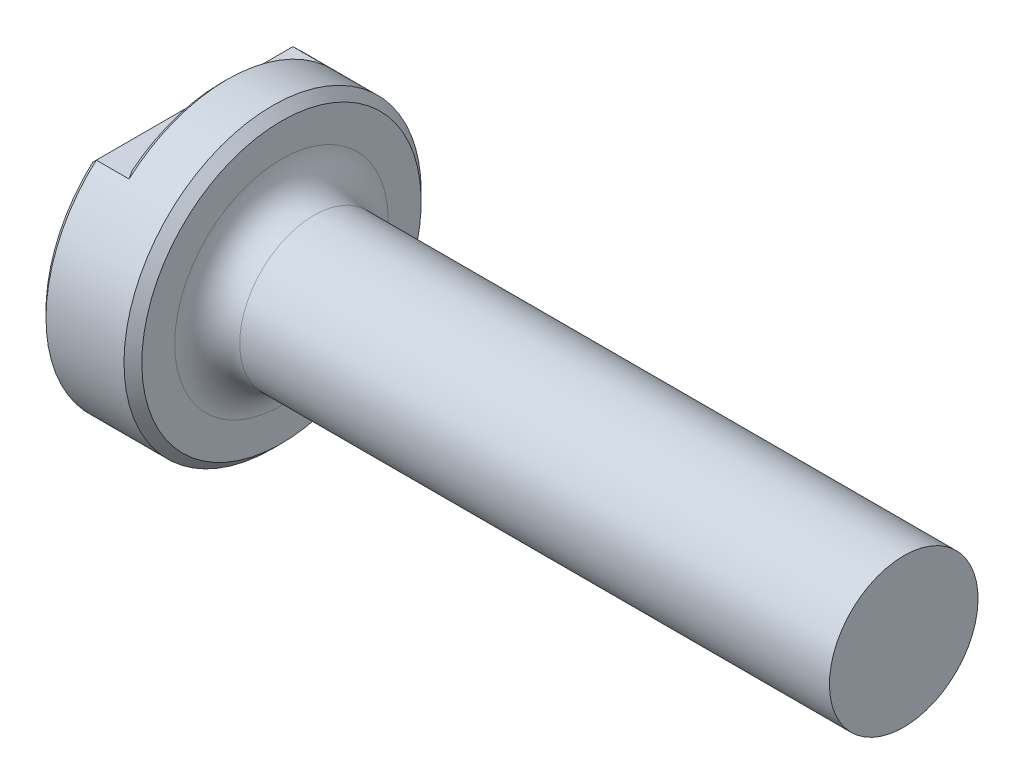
SolidWorks part; units mm, degrees
ref_plane "Front Plane" through (0, 0, 0) normal (0, 0, 1) x (1, 0, 0)
ref_plane "Top Plane" through (0, 0, 0) normal (0, 1, 0) x (1, 0, 0)
ref_plane "Right Plane" through (0, 0, 0) normal (1, 0, 0) x (0, 0, -1)
sketch "Sketch1" plane through (0, 0, 0) normal (1, 0, 0) x (0, 0, -1)
  circle A0 centre (0, 0) radius 25.4
  dimension "Rod Dia" = 50.8
extrude "Boss-Extrude1" add sketch "Sketch1" along normal mid plane 122.2375 contours A0
sketch "Sketch3" plane through (-61.1187, 0, 0) normal (-1, 0, 0) x (0, 0, 1)
  line L1 (-25.4, 25.4) -> (25.4, 25.4)
  line L2 (-25.4, 25.4) -> (-25.4, 19.05)
  line L3 (-25.4, 19.05) -> (25.4, 19.05)
  line L4 (25.4, 25.4) -> (25.4, 19.05)
  line L5 (-25.4, 25.4) -> (25.4, 19.05) construction
  line L6 (-25.4, 19.05) -> (25.4, 25.4) construction
  circle A0 centre (0, 0) radius 25.4 construction
  point P0 (0, 22.225)
  dimension "D1" = 19.05
extrude "Cut-Extrude1" cut sketch "Sketch3" against normal blind 5.588
sketch "Sketch5" plane through (0, 0, 0) normal (0, 0, 1) x (1, 0, 0)
  line L0 (61.1187, 0) -> (-61.1187, 0) construction
  line L1 (61.1187, -25.4) -> (61.1187, 25.4) construction
  line L2 (-61.1187, 19.05) -> (-61.1187, -25.4) construction
  line L3 (-45.2437, -12.7) -> (61.1187, -12.7)
  line L4 (61.1187, -12.7) -> (61.1187, -25.4)
  line L5 (61.1187, -25.4) -> (-45.2437, -25.4)
  line L6 (-61.1187, -25.4) -> (61.1187, -25.4) construction
  line L7 (-45.2437, -25.4) -> (-45.2437, -12.7)
  dimension "B" = 15.875
  dimension "D" = 25.4
revolve "Cut-Revolve1" cut sketch "Sketch5" angle 360 about L0
sketch "Sketch6" plane through (0, 0, 0) normal (0, 0, 1) x (1, 0, 0)
  line L0 (61.1187, 0) -> (-61.1187, 0) construction
  line L1 (61.1187, -12.7) -> (61.1187, 12.7) construction
  line L2 (-61.1187, 19.05) -> (-61.1187, -25.4) construction
  line L3 (-56.4959, 0) -> (-61.1187, 0)
  line L5 (-61.1188, 12.4402) -> (-61.1187, 0)
  arc A0 (-61.1188, 12.4402) -> (-56.4959, 0) centre (-75.546, 0) cw
  dimension "D1" = 19.05
  dimension "D2" = 4.6228
revolve "Cut-Revolve2" cut sketch "Sketch6" angle 360 about L0
sketch "Sketch7" plane through (0, 0, 0) normal (0, 0, 1) x (1, 0, 0)
  line L0 (-57.0029, 4.3656) -> (61.1188, 6.943)
  line L2 (61.1187, -12.7) -> (61.1187, 12.7) construction
  line L3 (-57.0029, 0) -> (61.1187, 0)
  line L4 (61.1187, 0) -> (-61.1187, 0) construction
  line L5 (-61.1187, 19.05) -> (-61.1187, -25.4) construction
  line L6 (61.1188, 6.943) -> (61.1187, 0)
  line L7 (-57.0029, 4.3656) -> (-57.0029, 0)
  line L8 (61.1187, 0) -> (41.1743, 0.1051)
  arc A1 (-61.1188, -12.4402) -> (-61.1188, 12.4402) centre (-75.546, 0) ccw construction
  dimension "D1" = 1.25
  dimension "D2" = 8.7312
revolve "Cut-Revolve3" [suppressed] cut sketch "Sketch7" angle 360 about L4
fillet "Fillet1" radius 5.5562 1 edges at (-45.2437, 12.7, 0)
chamfer "Chamfer1" distance 1.524 angle 45 1 edges at (-45.2437, 25.4, 0)
chamfer "Chamfer2" distance 1.016 angle 45 3 edges at (-55.5307, 25.4, 0) (-61.1187, -25.4, 0) (-61.1187, 19.05, 0)
